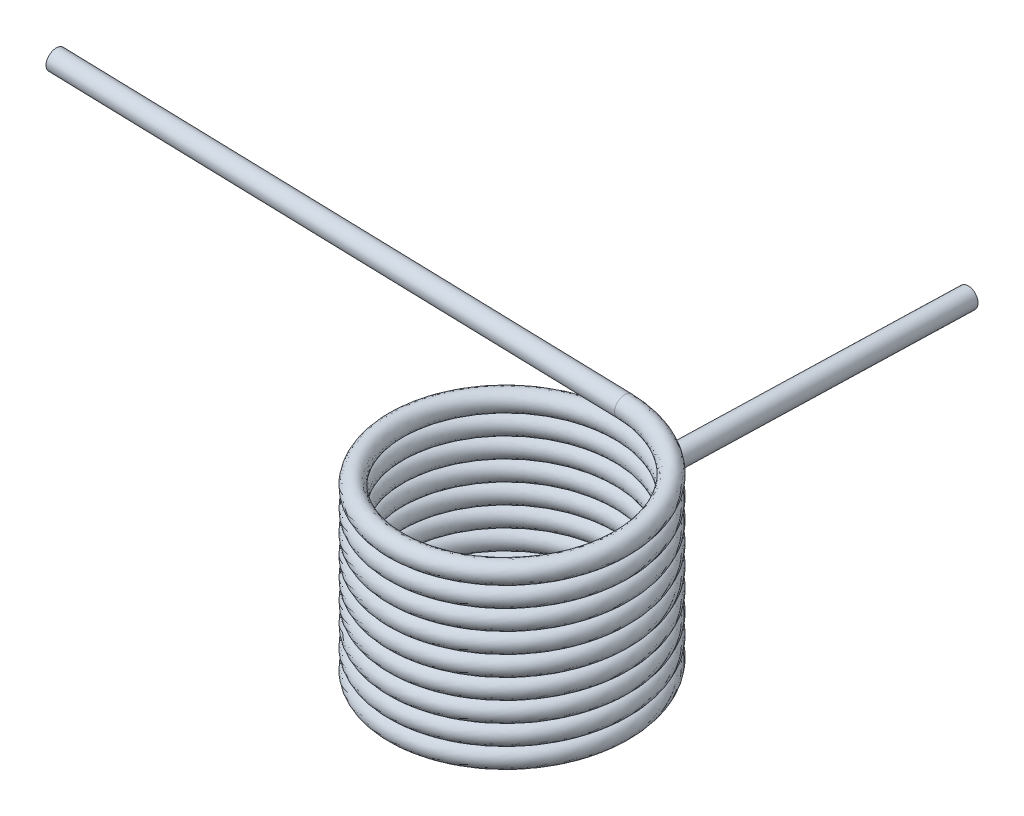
SolidWorks part; units mm, degrees
ref_plane "Front Plane" through (0, 0, 0) normal (0, 0, 1) x (1, 0, 0)
ref_plane "Top Plane" through (0, 0, 0) normal (0, 1, 0) x (1, 0, 0)
ref_plane "Right Plane" through (0, 0, 0) normal (1, 0, 0) x (0, 0, -1)
sketch "Sketch1" plane through (0, 0, 0) normal (0, 1, 0) x (1, 0, 0)
  circle A0 centre (0, 0) radius 10.0457
  dimension "D1" = 20.0914
curve "Helix/Spiral1"
sweep "Sweep1" add path "Helix/Spiral1" parameters "D3"=1.778
sketch "Sketch14" plane through (-0.4385, 0.0124, 0) normal (-0.9996, 0.0282, 0) x (0, 0, 1)
  circle A1 centre (-10.0457, 15.5624) radius 0.889
  circle A3 centre (-10.0457, 15.5624) radius 0.889
  dimension "D1" = 0
extrude "Boss-Extrude3" add sketch "Sketch14" along normal blind 50.8
sketch "Sketch17" plane through (0, 0, 0) normal (0, -0.0282, -0.9996) x (1, 0, 0)
  circle A1 centre (-10.0457, 0) radius 0.889
  circle A2 centre (-10.0457, 0) radius 0.889
  dimension "D1" = 0
extrude "Boss-Extrude4" add sketch "Sketch17" along normal blind 50.8
sketch "Sketch18" plane through (0, 0, 0) normal (0, 1, 0) x (1, 0, 0)
  circle A0 centre (0, 0) radius 10.4902
  dimension "D1" = 20.9804
sketch "Sketch19" plane through (0, 0, 0) normal (1, 0, 0) x (0, 0, -1)
  line L1 (11.0747, -1.3331) -> (-10.9888, -1.3331)
  line L2 (11.0747, -1.3331) -> (11.0747, 16.5124)
  line L3 (11.0747, 16.5124) -> (-10.9888, 16.5124)
  line L4 (-10.9888, -1.3331) -> (-10.9888, 16.5124)
  line L5 (11.0747, -1.3331) -> (-10.9888, 16.5124) construction
  line L6 (11.0747, 16.5124) -> (-10.9888, -1.3331) construction
  point P0 (0.043, 7.5896)
